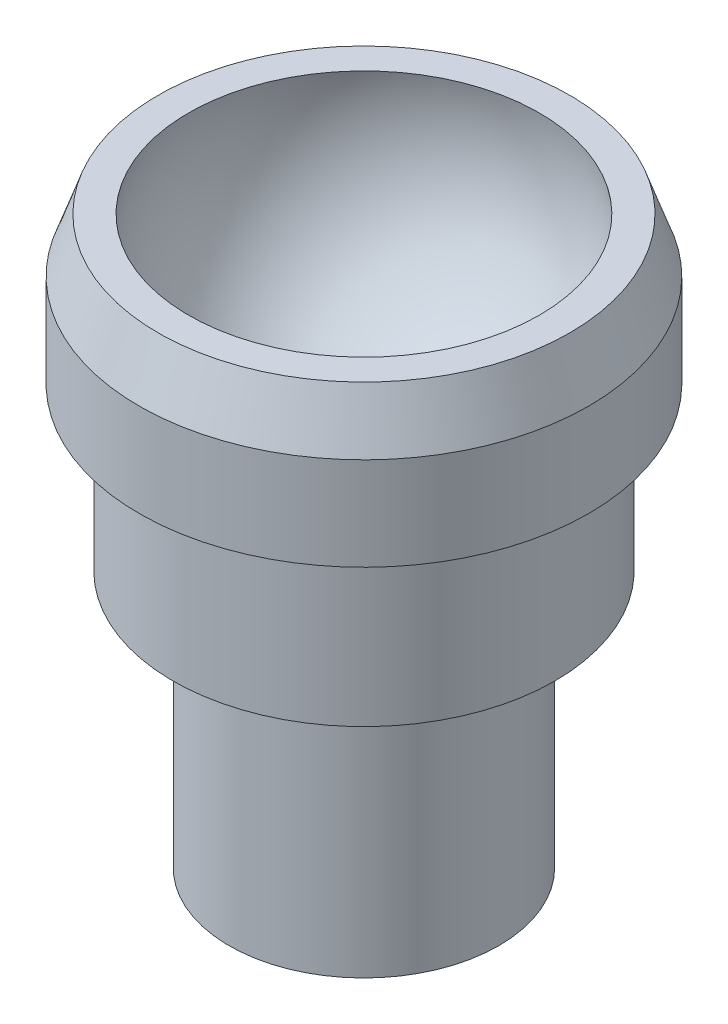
SolidWorks part; units mm, degrees
ref_plane "Plan de face" through (0, 0, 0) normal (0, 0, 1) x (1, 0, 0)
ref_plane "Plan de dessus" through (0, 0, 0) normal (0, 1, 0) x (1, 0, 0)
ref_plane "Plan de droite" through (0, 0, 0) normal (1, 0, 0) x (0, 0, -1)
sketch "Esquisse1" plane through (0, 0, 0) normal (0, 0, 1) x (1, 0, 0)
  line L0 (0, 3.9637) -> (0, -12)
  line L1 (0, -12) -> (5.0528, -12)
  line L2 (5.0528, -12) -> (6, -11.4531)
  line L3 (6, -11.4531) -> (6, -1.7469)
  line L4 (6, -1.7469) -> (5.0528, -1.2)
  line L5 (5.0528, -1.2) -> (5.0528, 0)
  line L6 (5.0528, 0) -> (8.5, 0)
  line L7 (8.5, 0) -> (8.5, 7.2)
  line L8 (8.5, 7.2) -> (10, 7.2)
  line L9 (10, 7.2) -> (10, 11.34)
  line L10 (10, 11.34) -> (9.1578, 13.74)
  line L11 (9.1578, 13.74) -> (7.8003, 13.74)
  line L12 (0, 13.74) -> (0, -12) construction
  arc A0 (7.8003, 13.74) -> (0, 3.9637) centre (0, 11.9637) cw
revolve "Révolution1" add sketch "Esquisse1" angle 360 about L12
